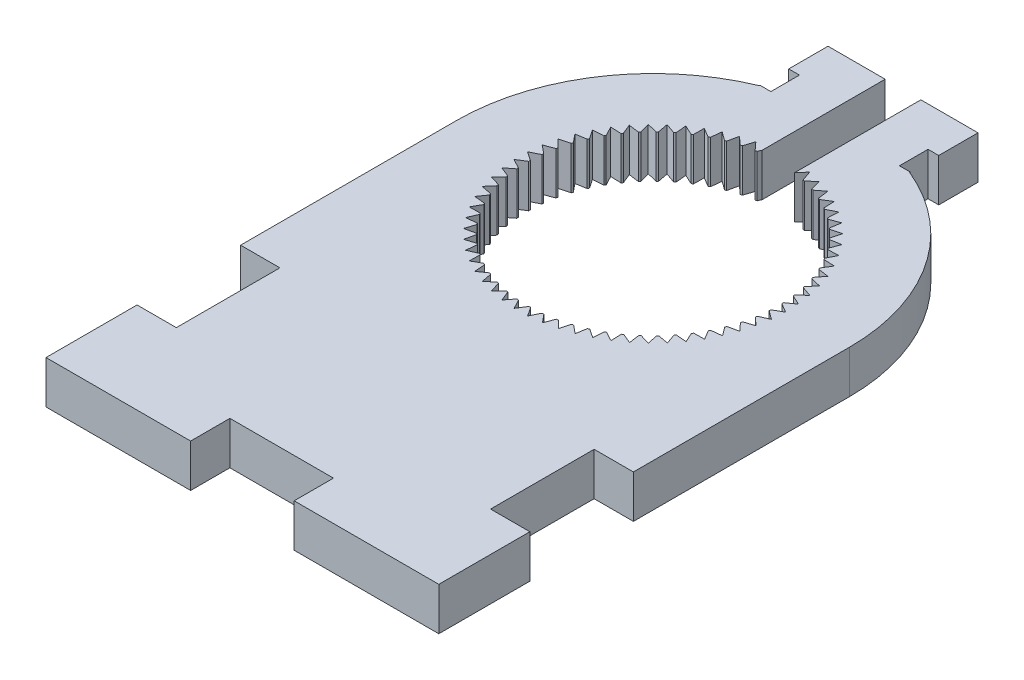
SolidWorks part; units mm, degrees
ref_plane "Front Plane" through (0, 0, 0) normal (0, 0, 1) x (1, 0, 0)
ref_plane "Top Plane" through (0, 0, 0) normal (0, 1, 0) x (1, 0, 0)
ref_plane "Right Plane" through (0, 0, 0) normal (1, 0, 0) x (0, 0, -1)
sketch "Sketch1" plane through (0, 0, 0) normal (0, 1, 0) x (1, 0, 0)
  line L0 (-27.5, 0) -> (-27.5, -57.5)
  line L1 (-27.5, -57.5) -> (27.5, -57.5)
  line L2 (27.5, -57.5) -> (27.5, 0)
  line L3 (0, 0) -> (0, 35) construction
  line L4 (2.5, 17.3205) -> (2.5, 35)
  line L5 (-2.5, 17.3205) -> (-2.5, 35)
  line L6 (-2.5, 0) -> (-2.5, 35) construction
  line L8 (-10.5, 35) -> (-2.5, 35)
  line L9 (2.5, 35) -> (10.5, 35)
  line L10 (-10.5, 25.4165) -> (-10.5, 25.5)
  line L11 (2.5, 0) -> (2.5, 35) construction
  line L12 (10.5, 25.4165) -> (10.5, 25.5)
  line L13 (-10.5, 29.5) -> (-10.5, 35)
  line L14 (-10.5, 29.5) -> (-9, 29.5)
  line L16 (-10.5, 25.5) -> (-9, 25.5)
  line L17 (-9, 29.5) -> (-9, 25.5)
  line L18 (10.5, 25.5) -> (9, 25.5)
  line L19 (9, 29.5) -> (9, 25.5)
  line L20 (10.5, 29.5) -> (9, 29.5)
  line L21 (10.5, 29.5) -> (10.5, 35)
  arc A0 (-2.5, 17.3205) -> (2.5, 17.3205) centre (0, 0) ccw
  arc A1 (27.5, 0) -> (10.5, 25.4165) centre (0, 0) ccw
  arc A2 (-10.5, 25.4165) -> (-27.5, 0) centre (0, 0) ccw
  point P16 (-9.8117, 35.7831)
  point P20 (-9.8117, 35.7831)
  dimension "D1" = 35
  dimension "D2" = 10
  dimension "D3" = 30
  dimension "D4" = 2.5
  dimension "D6" = 35
  dimension "D7" = 8
  dimension "D9" = 4
  dimension "D10" = 1.5
  dimension "D11" = 1.5
  dimension "D12" = 5.5
  dimension "D5" = 2.5
extrude "Boss-Extrude1" add sketch "Sketch1" along normal mid plane 6
sketch "Sketch2" plane through (0, 3, 0) normal (0, 1, 0) x (1, 0, 0)
  line L0 (2.5, 17.3205) -> (3.9741, 17.0428)
  line L1 (3.9741, 17.0428) -> (3.4775, 18.4582)
  line L2 (3.4775, 18.4582) -> (2.5, 17.3205)
  arc A0 (-2.5, 17.3205) -> (2.5, 17.3205) centre (0, 0) ccw construction
  point P6 (2.212, 18.1154)
  dimension "D1" = 1.5
extrude "Cut-Extrude1" cut sketch "Sketch2" against normal blind 6
pattern_circular "CirPattern1" count 63 over 360 about axis through (0, 0, 0) along (0, 1, 0) of "Cut-Extrude1"
sketch "Sketch3" plane through (0, 3, 0) normal (0, 1, 0) x (1, 0, 0)
  line L0 (0, 0) -> (0, -57.6205) construction
  line L1 (-27.5, -57.5) -> (27.5, -57.5) construction
  line L2 (-7.25, -63) -> (7.25, -63)
  line L3 (-7.25, -63) -> (-7.25, -52)
  line L4 (-7.25, -52) -> (7.25, -52)
  line L5 (7.25, -63) -> (7.25, -52)
  line L6 (-7.25, -63) -> (7.25, -52) construction
  line L7 (-7.25, -52) -> (7.25, -63) construction
  line L8 (0, -37.5) -> (50000, -37.5) construction
  line L9 (-27.5, 0) -> (-27.5, -57.5) construction
  line L10 (-33, -30.25) -> (-22, -30.25)
  line L11 (-33, -30.25) -> (-33, -44.75)
  line L12 (-33, -44.75) -> (-22, -44.75)
  line L13 (-22, -30.25) -> (-22, -44.75)
  line L14 (-33, -30.25) -> (-22, -44.75) construction
  line L15 (-33, -44.75) -> (-22, -30.25) construction
  line L16 (33, -44.75) -> (22, -30.25) construction
  line L17 (33, -30.25) -> (22, -44.75) construction
  line L18 (22, -30.25) -> (22, -44.75)
  line L19 (33, -44.75) -> (22, -44.75)
  line L20 (33, -30.25) -> (33, -44.75)
  line L21 (33, -30.25) -> (22, -30.25)
  point P3 (0, -57.5)
  point P12 (-27.5, -37.5)
  point P23 (27.5, -37.5)
  dimension "D1" = 5.5
  dimension "D2" = 14.5
  dimension "D3" = 20
  dimension "D4" = 14.5
  dimension "D5" = 5.5
extrude "Cut-Extrude2" cut sketch "Sketch3" against normal blind 6
